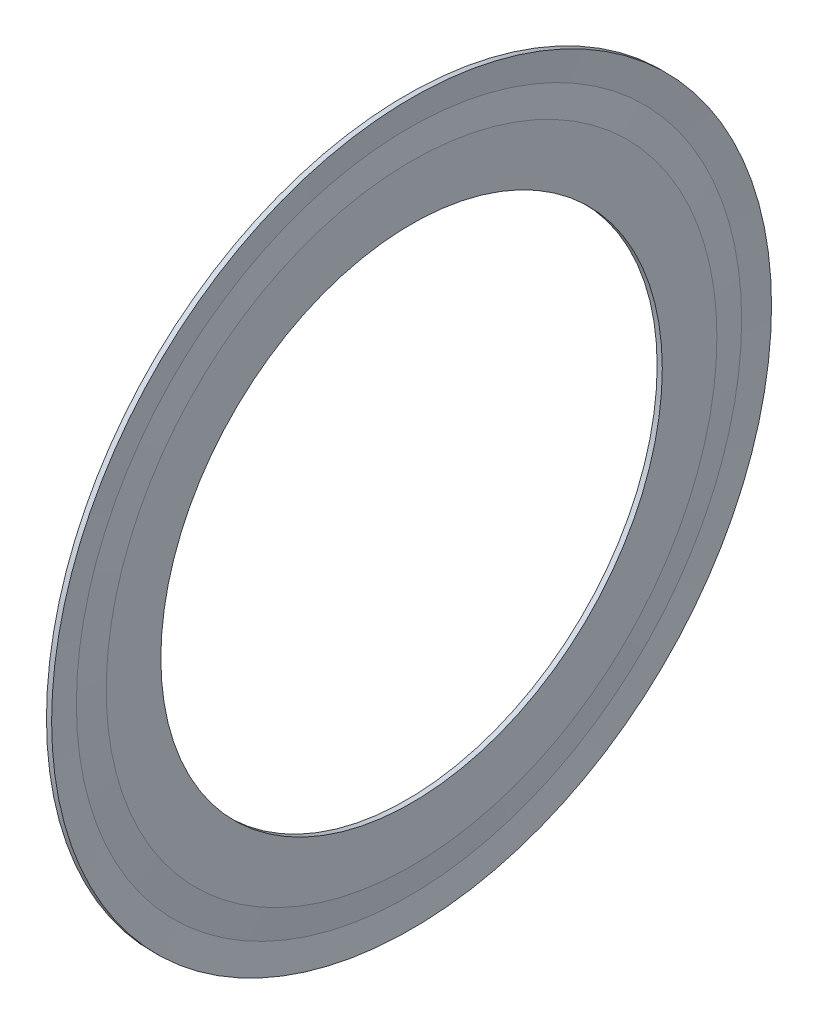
SolidWorks part; units mm, degrees
ref_plane "Front Plane" through (0, 0, 0) normal (0, 0, 1) x (1, 0, 0)
ref_plane "Top Plane" through (0, 0, 0) normal (0, 1, 0) x (1, 0, 0)
ref_plane "Right Plane" through (0, 0, 0) normal (1, 0, 0) x (0, 0, -1)
ref_plane "Plane4" through (0, 0, 0) normal (0, 0, 1) x (1, 0, 0)
sketch "Sketch1" plane through (0, 0, 0) normal (0, 0, 1) x (1, 0, 0)
  line L0 (4.483, 6.6854) -> (4.483, 6.15)
  line L1 (4.483, 6.15) -> (4.5865, 5.05)
  line L2 (4.5865, 5.05) -> (4.69, 5.05)
  line L3 (4.69, 5.05) -> (4.69, 6.15)
  line L4 (4.69, 6.15) -> (4.6383, 6.7)
  line L5 (4.6383, 6.7) -> (4.69, 7.25)
  line L6 (4.69, 7.25) -> (4.5865, 7.25)
  line L7 (4.5865, 7.25) -> (4.483, 6.6854)
  line L8 (50, 0) -> (-50, 0) construction
revolve "Revolve1" add sketch "Sketch1" angle 360 about L8
